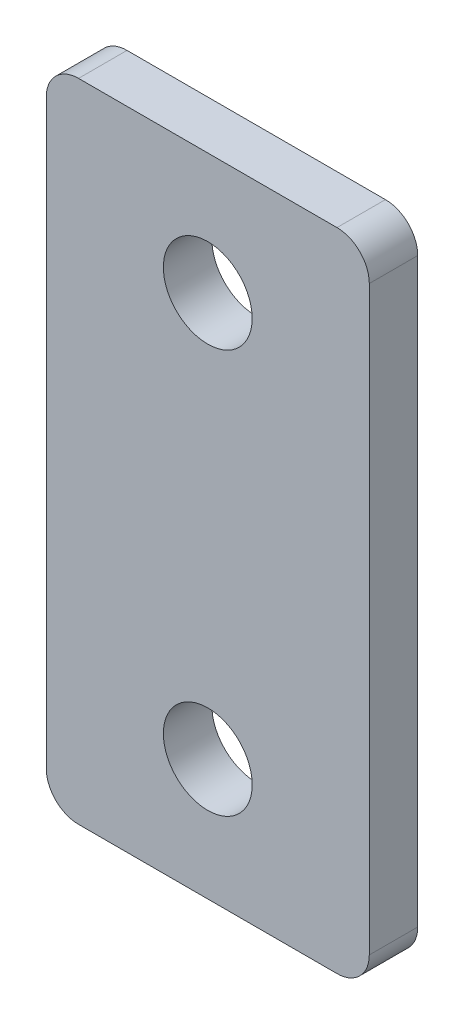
SolidWorks part; units mm, degrees
ref_plane "Plan1" through (0, 0, 0) normal (0, 0, 1) x (1, 0, 0)
ref_plane "Plan2" through (0, 0, 0) normal (0, 1, 0) x (1, 0, 0)
ref_plane "Plan3" through (0, 0, 0) normal (1, 0, 0) x (0, 0, -1)
sketch "Esquisse1" plane through (0, 0, 0) normal (0, 0, 1) x (1, 0, 0)
  line L0 (2, 40) -> (18, 40)
  line L1 (0, 38) -> (0, 2)
  line L2 (18, 0) -> (2, 0)
  line L3 (20, 2) -> (20, 38)
  arc A0 (0, 38) -> (2, 40) centre (2, 38) cw
  arc A1 (2, 0) -> (0, 2) centre (2, 2) cw
  arc A2 (20, 2) -> (18, 0) centre (18, 2) cw
  arc A3 (20, 38) -> (18, 40) centre (18, 38) ccw
  circle A4 centre (10, 32.5) radius 2.75
  circle A5 centre (10, 7.5) radius 2.75
  point P6 (0, 40)
  point P9 (0, 0)
  point P12 (20, 0)
  dimension "D3" = 2
  dimension "D6" = 5.5
  dimension "D4" = 7.5
  dimension "D1" = 20
  dimension "D2" = 40
  dimension "D5" = 10
  dimension "D7" = 25
extrude "Base-Extrusion" add sketch "Esquisse1" along normal blind 3
